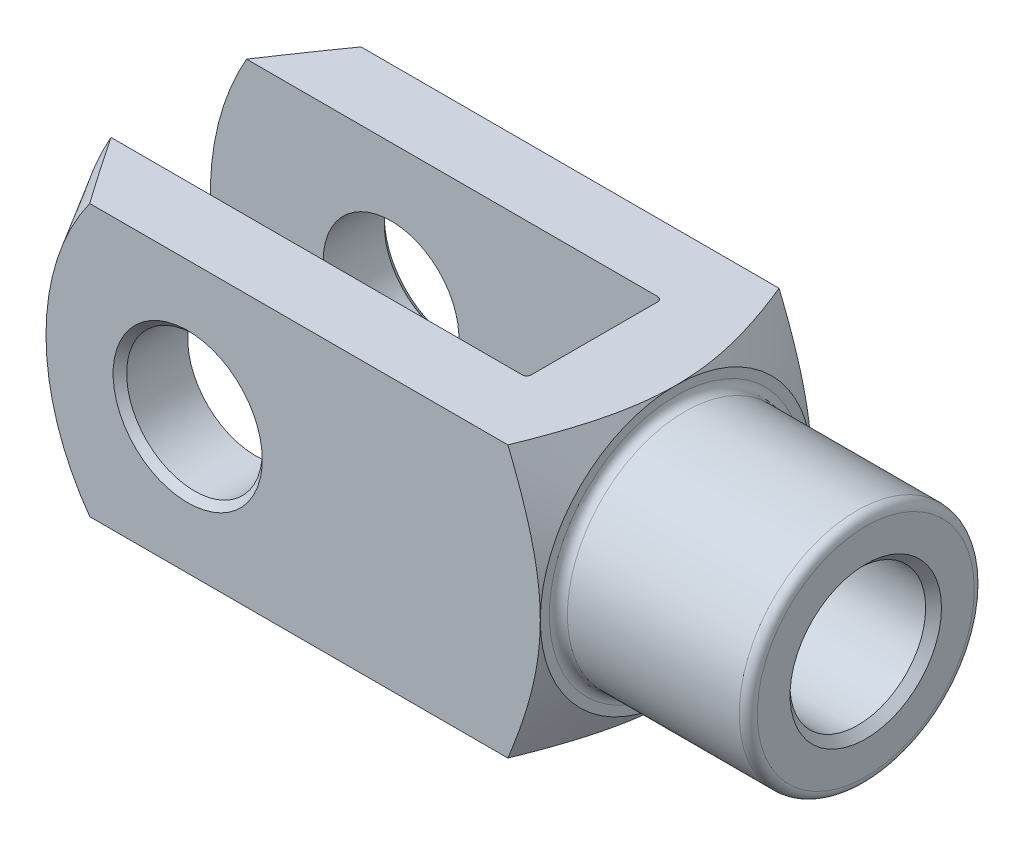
SolidWorks part; units mm, degrees
ref_plane "Front Plane" through (0, 0, 0) normal (0, 0, 1) x (1, 0, 0)
ref_plane "Top Plane" through (0, 0, 0) normal (0, 1, 0) x (1, 0, 0)
ref_plane "Right Plane" through (0, 0, 0) normal (1, 0, 0) x (0, 0, -1)
sketch "Sketch1" plane through (0, 0, 0) normal (1, 0, 0) x (0, 0, -1)
  line L0 (0, 0) -> (0, 50000) construction
  line L1 (0, 0) -> (50000, 0) construction
  line L2 (-30, -30) -> (-30, 30)
  line L3 (-30, 30) -> (30, 30)
  line L4 (30, -30) -> (30, 30)
  line L5 (-30, -30) -> (30, -30)
  point P9 (0, 30)
  point P11 (30, 0)
  point P12 (-30, 0)
  dimension "D1" = 60
  dimension "D2" = 60
extrude "Extrude1" add sketch "Sketch1" against normal blind 160
sketch "Sketch2" plane through (0, 0, 0) normal (1, 0, 0) x (0, 0, -1)
  circle A0 centre (0, 0) radius 26
  circle A1 centre (0, 0) radius 52
  dimension "D1" = 52
  dimension "D2" = 104
extrude "Extrude2" cut sketch "Sketch2" against normal blind 42
sketch "Sketch3" plane through (0, 0, 30) normal (0, 0, 1) x (1, 0, 0)
  circle A0 centre (-120, 0) radius 15
  dimension "D1" = 30
  dimension "D2" = 120
extrude "Extrude3" cut sketch "Sketch3" against normal through all
sketch "Sketch4" plane through (0, 30, 0) normal (0, 1, 0) x (1, 0, 0)
  line L0 (0, 0) -> (-50000, 0) construction
  line L1 (-160, -15) -> (-160, 15)
  line L2 (-160, 30) -> (-160, -30) construction
  line L3 (-160, 15) -> (-60, 15)
  line L4 (-60, 15) -> (-60, -15)
  line L5 (-120, 30) -> (-120, -30) construction
  line L6 (-160, -15) -> (-60, -15)
  point P7 (-120, 0)
  point P13 (-60, 0)
  point P14 (-160, 0)
  dimension "D1" = 60
  dimension "D2" = 30
extrude "Extrude4" cut sketch "Sketch4" against normal through all
fillet "Fillet1" radius 1 2 edges at (-60, 0, 15) (-60, 0, -15)
fillet "Fillet2" radius 2 2 edges at (0, 0, -26) (-42, 0, -26)
chamfer "Chamfer2" distance 1.5 angle 45 2 edges at (-105, 0, -30) (-105, 0, 30)
sketch "Sketch6" plane through (0, 0, 0) normal (0, 0, 1) x (1, 0, 0)
  line L0 (-42, -30) -> (-42, -60)
  line L1 (-42, -60) -> (-59.3205, -60)
  line L2 (-59.3205, -60) -> (-42, -30)
  dimension "D1" = 30
  dimension "D2" = 60
revolve "Cut-Revolve1" cut sketch "Sketch6" angle 360 about axis through (-42, 0, 0) along (1, 0, 0)
sketch "Sketch7" plane through (0, 0, 0) normal (0, 1, 0) x (1, 0, 0)
  line L0 (-151.3397, -30) -> (-160, -15)
  line L1 (-160, 15) -> (-151.3397, 30)
  line L2 (-151.3397, 30) -> (-220, 30)
  line L3 (-160, 15) -> (-160, -15)
  line L4 (-220, 30) -> (-220, -30)
  line L5 (-220, -30) -> (-151.3397, -30)
  line L6 (-160, 30) -> (-49.1744, 30) construction
  line L7 (-160, -30) -> (-49.1744, -30) construction
  line L8 (-100, 0.6162) -> (-100, 50000.6162) construction
  dimension "D1" = 120
  dimension "D2" = 60
  dimension "D3" = 60
revolve "Cut-Revolve2" cut sketch "Sketch7" angle 180 about L8
sketch "Sketch8" plane through (0, 0, 0) normal (1, 0, 0) x (0, 0, -1)
  circle A0 centre (0, 0) radius 15
  dimension "D1" = 30
extrude "Extrude5" cut sketch "Sketch8" against normal through all
chamfer "Chamfer3" distance 1.75 angle 45 1 edges at (0, 0, -15)
equation "\"D2@Sketch1\" = \"D1@Sketch1\""
equation "\"D2@Sketch2\" = \"D1@Sketch2\"*2"
equation "\"D2@Sketch6\" = \"D1@Sketch1\""
equation "\"D2@Sketch7\" = \"D1@Sketch1\""
equation "\"D3@Sketch7\" = \"D1@Sketch1\""
